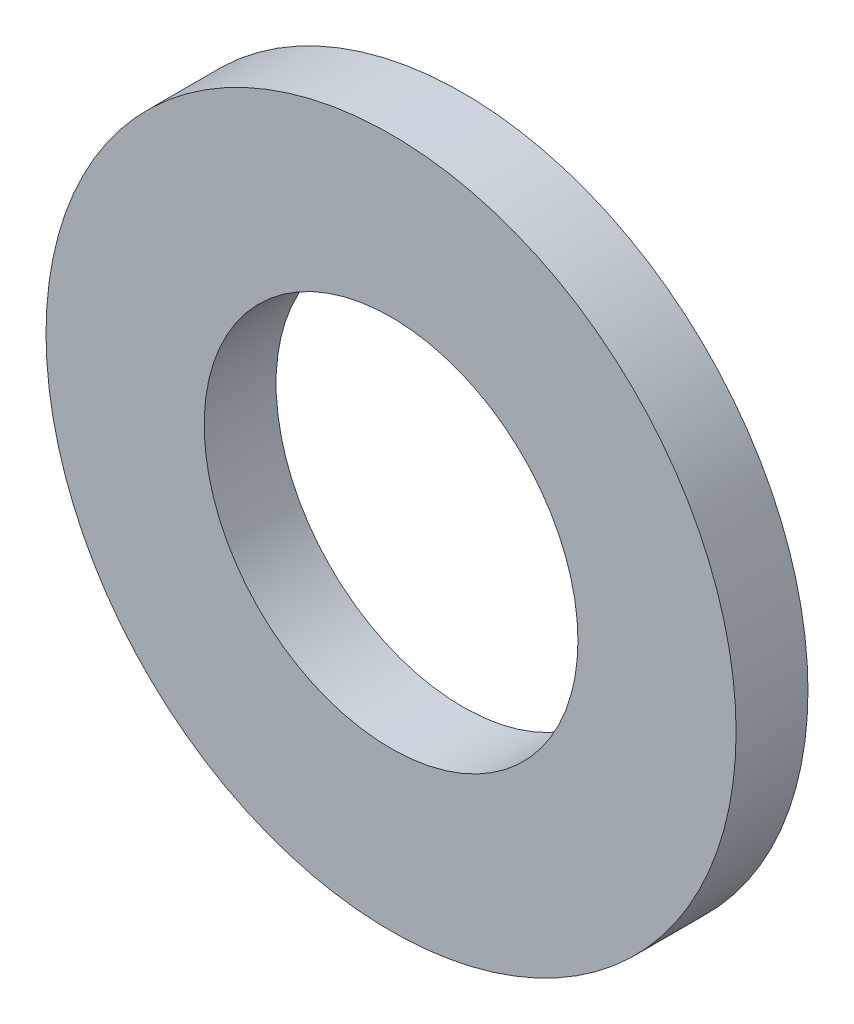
SolidWorks part; units mm, degrees
ref_plane "Plan1" through (0, 0, 0) normal (0, 0, 1) x (1, 0, 0)
ref_plane "Plan2" through (0, 0, 0) normal (0, 1, 0) x (1, 0, 0)
ref_plane "Plan3" through (0, 0, 0) normal (1, 0, 0) x (0, 0, -1)
sketch "Sketch1" plane through (0, 0, 0) normal (0, 0, 1) x (1, 0, 0)
  circle A0 centre (0, 0) radius 12
  dimension "D2" = 24
extrude "Base-Extrude" add sketch "Sketch1" along normal blind 2.5
other "Hole1"
sketch "Sketch2" plane through (0, 0, 2.5) normal (0, 0, 1) x (1, 0, 0)
  circle A0 centre (0, 0) radius 6.5
  circle A1 centre (0, 0) radius 12 construction
  dimension "D1" = 13
